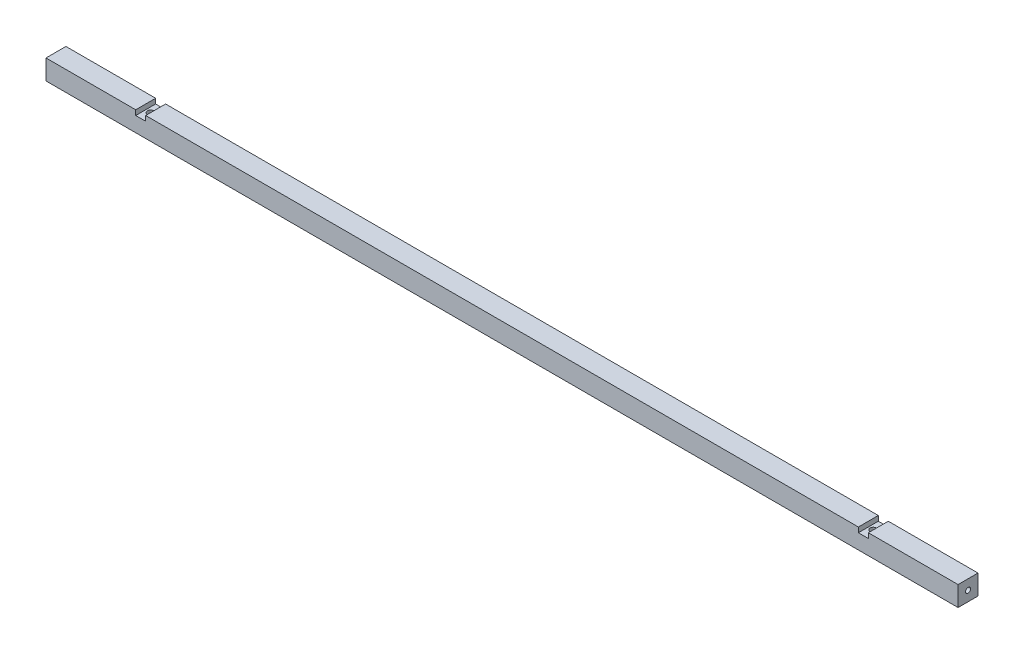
SolidWorks part; units mm, degrees
ref_plane "Plan de face" through (0, 0, 0) normal (0, 0, 1) x (1, 0, 0)
ref_plane "Plan de dessus" through (0, 0, 0) normal (0, 1, 0) x (1, 0, 0)
ref_plane "Plan de droite" through (0, 0, 0) normal (1, 0, 0) x (0, 0, -1)
sketch "Esquisse1" plane through (0, 0, 0) normal (0, 0, 1) x (1, 0, 0)
  line L0 (0, 0) -> (915, 0)
  line L1 (915, 0) -> (915, 20)
  line L2 (915, 20) -> (825, 20)
  line L3 (825, 20) -> (825, 15)
  line L4 (825, 15) -> (815, 15)
  line L5 (815, 15) -> (815, 20)
  line L6 (815, 20) -> (100, 20)
  line L7 (100, 20) -> (100, 15)
  line L8 (100, 15) -> (90, 15)
  line L9 (90, 15) -> (90, 20)
  line L10 (90, 20) -> (0, 20)
  line L11 (0, 20) -> (0, 0)
  dimension "D1" = 915
  dimension "A" = 90
  dimension "D3" = 10
  dimension "D4" = 10
  dimension "D6" = 20
  dimension "D7" = 20
  dimension "D8" = 20
  dimension "D9" = 5
  dimension "D10" = 5
extrude "Extrusion1" add sketch "Esquisse1" along normal mid plane 20
sketch "Esquisse2" plane through (0, 15, 0) normal (0, 1, 0) x (-1, 0, 0)
  line L0 (-457.5, -10) -> (-457.5, 75.2199) construction
  line L1 (-815, -10) -> (-100, -10) construction
  line L2 (-825, 10) -> (-815, 10) construction
  line L3 (-90, 10) -> (-90, -10) construction
  circle A0 centre (-820, 0) radius 3.25
  circle A1 centre (-95, 0) radius 3.25
  dimension "D1" = 6.5
  dimension "D2" = 10
  dimension "D3" = 5
  dimension "D4" = 5
extrude "Enlèv. mat.-Extru.1" cut sketch "Esquisse2" against normal up to next
hole_wizard "Trou taraudé M61" positions "Esquisse3D1" profile "Esquisse3" tap size "M6" standard "ISO"
sketch3d "Esquisse3D1"
  line L1 (0, 0, 10) -> (0, 0, -10) construction
  line L3 (0, 20, -10) -> (0, 0, -10) construction
  line L4 (915, 0, 10) -> (915, 0, -10) construction
  line L5 (915, 0, -10) -> (915, 20, -10) construction
  point P0 (0, 10, 0)
  point P1 (915, 10, 0)
  dimension "D1" = 10
  dimension "D2" = 10
  dimension "D3" = 10
  dimension "D4" = 10
sketch "Esquisse3" plane through (0, 10, 0) normal (0, 1, 0) x (0, 0, 1)
  line L0 (0, 0) -> (0, 19.5022)
  line L1 (0, 19.5022) -> (2.5, 18)
  line L2 (2.5, 18) -> (2.5, 0)
  line L5 (2.5, 0) -> (0, 0)
  line L10 (0, 19.5022) -> (-2.5, 18) construction
  line L11 (0, -6.35) -> (0, 107.95) construction
  dimension "Diamètre du trou pour taraudage" = 5
  dimension "Profondeur du trou pour taraudage" = 18
  dimension "Angle de pointe" = 118
